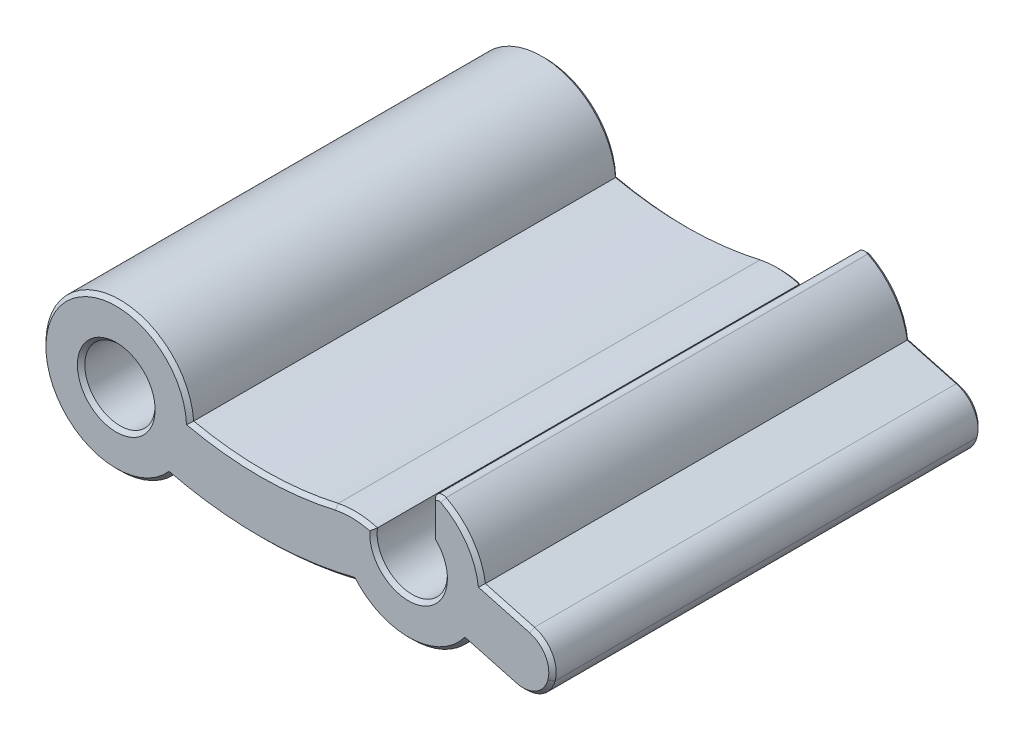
SolidWorks part; units mm, degrees
ref_plane "Front Plane" through (0, 0, 0) normal (0, 0, 1) x (1, 0, 0)
ref_plane "Top Plane" through (0, 0, 0) normal (0, 1, 0) x (1, 0, 0)
ref_plane "Right Plane" through (0, 0, 0) normal (1, 0, 0) x (0, 0, -1)
sketch "Sketch1" plane through (66.41, 0, 0) normal (0, 0, -1) x (-1, 0, 0)
  line L5 (-7.9984, -91.5648) -> (-15.7213, -93.652) construction
  line L6 (-15.7213, -93.652) -> (-11.8598, -92.6084) construction
  line L7 (-13.7689, -94.7818) -> (-11.12, -94.0659)
  line L8 (-14.6038, -91.6926) -> (-11.9549, -90.9767)
  line L9 (-16.1387, -92.1074) -> (-12.2773, -91.0638) construction
  line L10 (-15.3039, -95.1966) -> (-11.4424, -94.153) construction
  line L11 (-15.7239, -93.6424) -> (-15.7187, -93.6617)
  line L13 (-9.2484, -87.7651) -> (-9.2484, -90.1339)
  circle A0 centre (7.8016, -91.5648) radius 1.9
  arc A1 (4.876, -94.2925) -> (3.8139, -91.2524) centre (7.8016, -91.5648) ccw
  arc A2 (-9.2484, -90.1339) -> (-6.1196, -91.2818) centre (-7.9984, -91.5648) ccw
  arc A3 (-9.2484, -87.7651) -> (-11.9549, -90.9767) centre (-7.9984, -91.5648) ccw
  arc A4 (-5.3764, -92.4925) -> (4.7016, -92.6885) centre (0.0279, -73.8159) ccw construction
  arc A5 (-5.0269, -94.2425) -> (4.876, -94.2925) centre (0.0279, -73.8159) ccw
  arc A6 (-3.9984, -91.1984) -> (3.8139, -91.2524) centre (0.0279, -73.8159) ccw
  arc A7 (-4.9316, -90.9555) -> (4.317, -91.1355) centre (0.0279, -73.8159) ccw construction
  arc A8 (-5.8211, -94.0294) -> (5.0862, -94.2416) centre (0.0279, -73.8159) ccw construction
  arc A9 (-13.7689, -94.7818) -> (-15.7187, -93.6617) centre (-14.1838, -93.2468) cw
  arc A10 (-14.6038, -91.6926) -> (-15.7239, -93.6424) centre (-14.189, -93.2275) ccw
  arc A11 (-11.12, -94.0659) -> (-5.0269, -94.2425) centre (-7.9984, -91.5648) ccw
  arc A12 (-6.1196, -91.2818) -> (-3.9984, -91.1984) centre (-4.8924, -95.4785) cw
  dimension "D1" = 3.8
  dimension "D2" = 8
  dimension "D3" = 3.8
  dimension "D4" = 8
  dimension "D9" = 1.59
  dimension "D10" = 4.3724
  dimension "D5" = 1.6
  dimension "D11" = 4
  dimension "D12" = 15.8
  dimension "D13" = 105.124
  dimension "D14" = 8
  dimension "D15" = 1.25
  dimension "D16" = 122.574
  dimension "D6" = 1.6
  dimension "D7" = 1.6
  dimension "D8" = 1.6
extrude "Boss-Extrude1" add sketch "Sketch1" along normal blind 23.2 separate body
fillet "Fillet1" radius 0.4 1 edges at (75.6584, -87.7651, -11.6)
chamfer "Chamfer1" distance 0.2 angle 45 30 edges at (78.8545, -94.4238, 0) (81.3858, -94.6255, 0) (82.1313, -93.652, 0) (81.9777, -92.4355, 0) (79.6894, -91.3347, 0) (77.6613, -89.237, 0) (75.8502, -88.0236, 0) (75.6584, -89.2496, 0) (74.5243, -95.5631, 0) (75.0628, -93.3486, 0) (71.4741, -91.1095, 0) (66.4884, -94.8584, 0) (66.5053, -91.6582, 0) (54.8322, -90.2456, 0) (56.7084, -91.5648, 0) (56.7084, -91.5648, -23.2) (75.6584, -89.2496, -23.2) (75.8502, -88.0236, -23.2) (77.6613, -89.237, -23.2) (79.6894, -91.3347, -23.2) (81.9777, -92.4355, -23.2) (82.1313, -93.652, -23.2) (81.3858, -94.6255, -23.2) (75.0628, -93.3486, -23.2) (71.4741, -91.1095, -23.2) (78.8545, -94.4238, -23.2) (74.5243, -95.5631, -23.2) (66.4884, -94.8584, -23.2) (54.8322, -90.2456, -23.2) (66.5053, -91.6582, -23.2)
